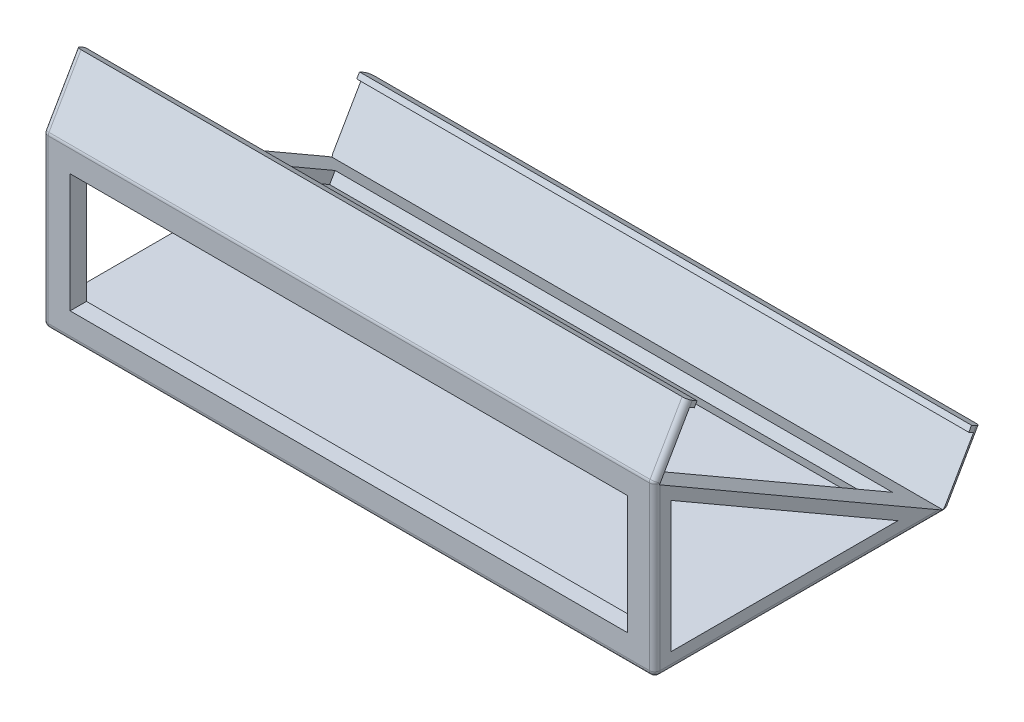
SolidWorks part; units mm, degrees
ref_plane "前基準面" through (0, 0, 0) normal (0, 0, 1) x (1, 0, 0)
ref_plane "上基準面" through (0, 0, 0) normal (0, 1, 0) x (1, 0, 0)
ref_plane "右基準面" through (0, 0, 0) normal (1, 0, 0) x (0, 0, -1)
sketch "草圖1" plane through (0, 0, 0) normal (1, 0, 0) x (0, 0, -1)
  line L0 (0, 0) -> (-53.6936, 0)
  line L1 (0, 0) -> (-53.6936, 31)
  line L2 (-53.6936, 31) -> (-53.6936, 0)
  dimension "D1" = 30
  dimension "D2" = 62
extrude "填料-伸長2" add sketch "草圖1" along normal blind 112
ref_plane "平面1" through (0, 0, 0) normal (0, -0.866, 0.5) x (-1, 0, 0)
sketch "草圖5" plane through (0, 0, 0) normal (0, -0.866, 0.5) x (-1, 0, 0)
  line L0 (-112, 0) -> (-112, -62) construction
  line L1 (0, 0) -> (-112, 0)
  line L2 (0, 0) -> (0, -1)
  line L3 (0, -1) -> (-112, -1)
  line L4 (-112, 0) -> (-112, -1)
  line L6 (0, -62) -> (-112, -62)
  line L7 (0, -62) -> (0, -61)
  line L8 (0, -61) -> (-112, -61)
  line L9 (-112, -62) -> (-112, -61)
  dimension "D1" = 1
  dimension "D2" = 1
extrude "填料-伸長5" add sketch "草圖5" against normal blind 12 contours L2 L1 L4 L3 | L7 L6 L9 L8
sketch "草圖6" plane through (0, 30.5, 52.8275) normal (0, -0.5, -0.866) x (-1, 0, 0)
  line L0 (0, 12) -> (0, 0) construction
  line L1 (-112, 12) -> (0, 12)
  line L2 (-112, 12) -> (-112, 11)
  line L3 (-112, 11) -> (0, 11)
  line L4 (0, 12) -> (0, 11)
  dimension "D1" = 1
extrude "填料-伸長6" add sketch "草圖6" along normal blind 1
sketch "草圖8" plane through (0, 0.5, 0.866) normal (0, 0.5, 0.866) x (1, 0, 0)
  line L0 (112, 12) -> (112, 0) construction
  line L1 (0, 12) -> (112, 12)
  line L2 (0, 12) -> (0, 11)
  line L3 (0, 11) -> (112, 11)
  line L4 (112, 12) -> (112, 11)
  dimension "D1" = 1
extrude "填料-伸長7" add sketch "草圖8" along normal blind 1
fillet "圓角8" radius 1 8 edges at (0, 36.1962, 50.6936) (112, 36.1962, 50.6936) (112, 15.5, 53.6936) (112, 5.1962, -3) (56, 0, 0) (0, 5.1962, -3) (0, 0, 26.8468) (112, 0, 26.8468)
fillet "圓角9" radius 1 7 edges at (111.7071, 30.9215, 53.4007) (56, 31, 53.6936) (0.2929, 30.4142, 53.6936) (111.7071, 0.2929, 53.4007) (56, 0, 53.6936) (0.2929, 0.2929, 53.6936) (0, 15, 53.6936)
sketch "草圖9" plane through (0, 0, 0) normal (-1, 0, 0) x (0, 0, 1)
  line L6 (9.1962, 3) -> (50.6936, 3)
  line L7 (50.6936, 3) -> (50.6936, 26.9585)
  line L8 (50.6936, 26.9585) -> (9.1962, 3)
  line L9 (9.1962, 3) -> (50.6936, 3)
  line L10 (50.6936, 3) -> (50.6936, 26.9585)
  line L11 (50.6936, 26.9585) -> (9.1962, 3)
  dimension "D1" = 2
extrude "除料-伸長1" cut sketch "草圖9" against normal through all contours L9 L10 L11
sketch "草圖10" plane through (0, 0, 53.6936) normal (0, 0, 1) x (1, 0, 0)
  line L16 (107, 5) -> (107, 26.7321)
  line L17 (107, 26.7321) -> (5, 26.7321)
  line L18 (5, 26.7321) -> (5, 5)
  line L19 (5, 5) -> (107, 5)
  line L20 (107, 5) -> (107, 26.7321)
  line L21 (107, 26.7321) -> (5, 26.7321)
  line L22 (5, 26.7321) -> (5, 5)
  line L23 (5, 5) -> (107, 5)
  dimension "D1" = 4
extrude "除料-伸長3" cut sketch "草圖10" against normal up to next
sketch "草圖12" plane through (0, 0, 0) normal (0, 0.866, -0.5) x (1, 0, 0)
  line L8 (5, -6) -> (5, -56)
  line L9 (5, -56) -> (107, -56)
  line L10 (107, -56) -> (107, -6)
  line L11 (107, -6) -> (5, -6)
  line L12 (5, -6) -> (5, -56)
  line L13 (5, -56) -> (107, -56)
  line L14 (107, -56) -> (107, -6)
  line L15 (107, -6) -> (5, -6)
  dimension "D1" = 5
extrude "除料-伸長6" cut sketch "草圖12" against normal up to surface (2 mm away)
